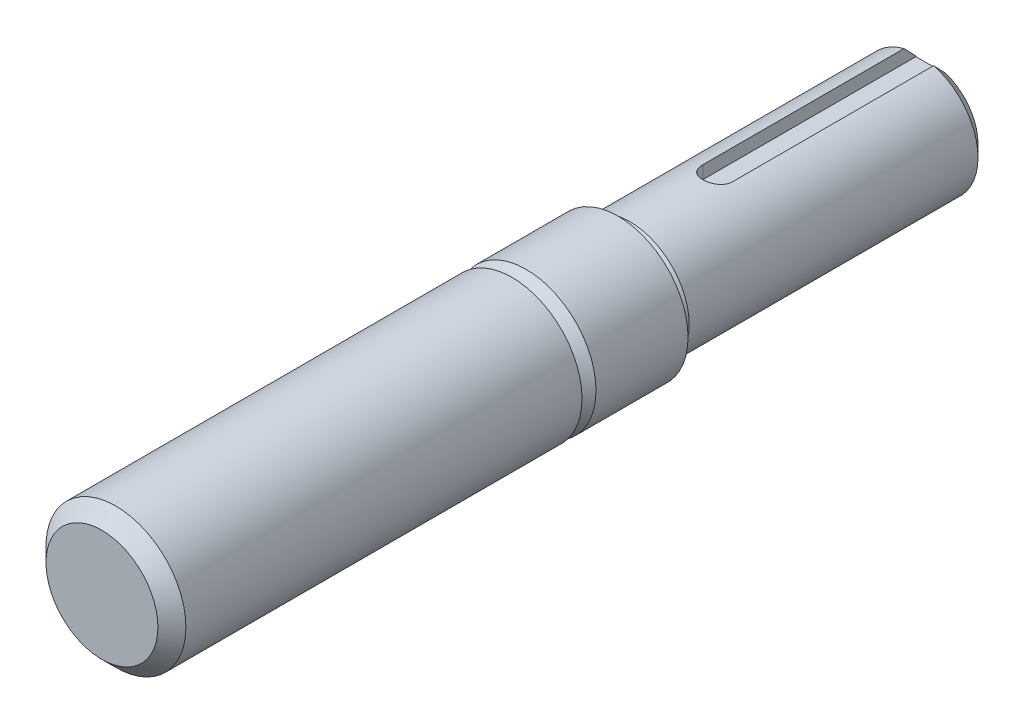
SolidWorks part; units mm, degrees
ref_plane "Front" through (0, 0, 0) normal (0, 0, 1) x (1, 0, 0)
ref_plane "Top" through (0, 0, 0) normal (0, 1, 0) x (1, 0, 0)
ref_plane "Right" through (0, 0, 0) normal (1, 0, 0) x (0, 0, -1)
sketch "Sketch1" plane through (0, 0, 0) normal (1, 0, 0) x (0, 0, -1)
  line L0 (0, 0) -> (65.3053, 0) construction
  line L1 (0, 0) -> (0, 6.0025)
  line L2 (0, 6.0025) -> (1.5006, 7.5032)
  line L3 (1.5006, 7.5032) -> (43.9928, 7.5032)
  line L4 (43.9928, 7.5032) -> (43.9928, 6.0025)
  line L5 (43.9928, 6.0025) -> (45.4934, 7.5032)
  line L6 (45.4934, 7.5032) -> (55.372, 7.5032)
  line L7 (55.372, 7.5032) -> (55.372, 5.715)
  line L8 (55.372, 5.715) -> (56.642, 6.35)
  line L9 (56.642, 6.35) -> (87.63, 6.35)
  line L10 (87.63, 6.35) -> (88.9, 5.08)
  line L11 (88.9, 5.08) -> (88.9, 0)
  line L12 (0, 0) -> (88.9, 0)
  dimension "D" = 15.0063
  dimension "DChamp1" = 1.5006
  dimension "DChamp2" = 1.5006
  dimension "E" = 43.9928
  dimension "DChamp4" = 1.5006
  dimension "DChamp3" = 1.5006
  dimension "B" = 55.372
  dimension "CChamp1" = 1.27
  dimension "A" = 88.9
  dimension "CChamp3" = 1.27
  dimension "CChamp4" = 1.27
  dimension "C" = 12.7
  dimension "D2" = 15.0063
  dimension "CChamp5" = 11.43
revolve "Revolve1" add sketch "Sketch1" angle 360 about L0
sketch "Sketch2" plane through (0, 0, -55.372) normal (0, 0, -1) x (-1, 0, 0)
  circle A0 centre (0, 0) radius 53.975
  dimension "D1" = 107.95
extrude "Type123-N" [suppressed] cut sketch "Sketch2" along normal through all
sketch "123KeyDepth" plane through (0, 0, -88.9) normal (0, 0, -1) x (-1, 0, 0)
  line L0 (0, 0) -> (0, 4.7625) construction
  line L1 (-0.5766, 4.7625) -> (0.5714, 4.7625) construction
  dimension "KeyDepth" = 4.7625
ref_plane "123Plane" through (0, 4.7625, 0) normal (0, -1, 0) x (1, 0, 0)
sketch "Sketch4" plane through (0, 4.7625, 0) normal (0, -1, 0) x (1, 0, 0)
  line L0 (0.0026, -88.9) -> (0.0026, -38.0533) construction
  line L1 (0.5766, -88.9) -> (-0.5714, -88.9) construction
  line L2 (1.5901, -88.9) -> (1.5901, -66.04)
  line L3 (-1.5849, -66.04) -> (-1.5849, -88.9)
  line L5 (-3.9689, -66.04) -> (2.9563, -66.04) construction
  line L6 (-5.08, -88.9) -> (5.08, -88.9) construction
  line L7 (-1.5849, -88.9) -> (1.5901, -88.9)
  arc A0 (1.5901, -66.04) -> (-1.5849, -66.04) centre (0.0026, -66.04) ccw
  dimension "F" = 3.175
  dimension "G" = 22.86
extrude "123Key" cut sketch "Sketch4" against normal through all
sketch "Sketch5" plane through (0, 0, -43.9928) normal (0, 0, -1) x (-1, 0, 0)
  circle A0 centre (0, 0) radius 63.5
  dimension "D1" = 127
extrude "Type4" [suppressed] cut sketch "Sketch5" along normal through all
chamfer "Type4-Chamfer" [suppressed] distance 2.54 angle 45
sketch "4KeyDepth" [suppressed] plane through (0, 0, -72.136) normal (0, 0, -1) x (-1, 0, 0)
  line L0 (0, 0) -> (0, 9.525) construction
  line L1 (-17.7759, 9.525) -> (18.3619, 9.525) construction
  dimension "Type4KeyDepth" = 6.2332
ref_plane "4Plane" [suppressed] through (0, 9.525, 0) normal (0, -1, 0) x (1, 0, 0)
sketch "Sketch7" [suppressed] plane through (0, 9.525, 0) normal (0, -1, 0) x (1, 0, 0)
  line L0 (-0.293, -72.136) -> (-0.293, -158.7004) construction
  line L1 (17.7759, -72.136) -> (-18.3619, -72.136) construction
  line L2 (2.882, -72.136) -> (2.882, -32.0291)
  line L3 (-3.468, -72.136) -> (-3.468, -32.0291)
  line L4 (-3.468, -72.136) -> (2.882, -72.136)
  line L5 (-10.16, -72.136) -> (10.16, -72.136) construction
  line L6 (-10.16, -72.136) -> (10.16, -72.136) construction
  arc A0 (2.882, -32.0291) -> (-3.468, -32.0291) centre (-0.293, -34.036) ccw
  dimension "4F" = 2.54
  dimension "4G" = 2.54
  dimension "4F2" = 1.27
extrude "4Key" [suppressed] cut sketch "Sketch7" against normal through all
equation "\"DChamp3@Sketch1\"=.1*\"D@Sketch1\""
equation "\"DChamp1@Sketch1\"=.1*\"D@Sketch1\""
equation "\"DChamp2@Sketch1\"=.1*\"D@Sketch1\""
equation "\"DChamp4@Sketch1\"=.1*\"D@Sketch1\""
equation "\"CChamp1@Sketch1\"=.1*\"C@Sketch1\""
equation "\"CChamp5@Sketch1\"=.9*\"C@Sketch1\""
equation "\"CChamp3@Sketch1\"=.1*\"C@Sketch1\""
equation "\"CChamp4@Sketch1\"=.1*\"C@Sketch1\""
equation "\"D2@Sketch1\"=\"D@Sketch1\""
equation "\"KeyDepth@123KeyDepth\"=(\"C@Sketch1\"/2)-(\"F@Sketch4\"/2)"
equation "\"Type4KeyDepth@4KeyDepth\"=(\"D@Sketch1\"/2)-(\"4F@Sketch7\"/2)"
equation "\"4F2@Sketch7\"=\"4F@Sketch7\"/2"
